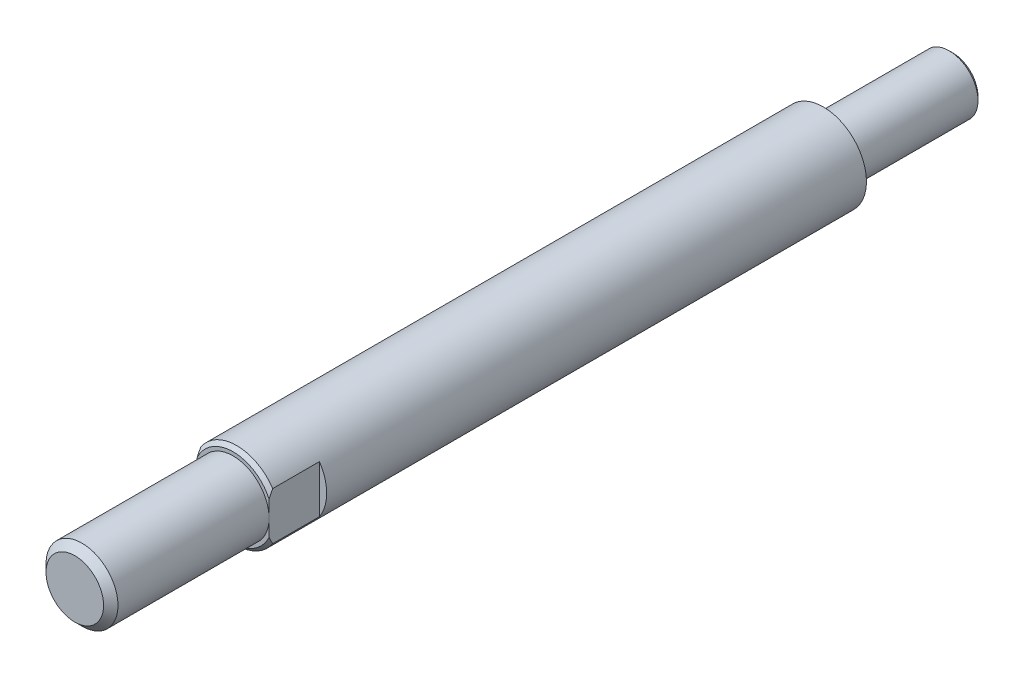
SolidWorks part; units mm, degrees
ref_plane "Face" through (0, 0, 0) normal (0, 0, 1) x (1, 0, 0)
ref_plane "Dessus" through (0, 0, 0) normal (0, 1, 0) x (1, 0, 0)
ref_plane "Profil" through (0, 0, 0) normal (1, 0, 0) x (0, 0, -1)
sketch "Esquisse1" plane through (0, 0, 0) normal (0, 0, 1) x (1, 0, 0)
  circle A0 centre (0, 0) radius 6
  dimension "D1" = 12
extrude "Extrusion1" add sketch "Esquisse1" along normal blind 122
sketch "Esquisse2" plane through (0, 0, 122) normal (0, 0, 1) x (1, 0, 0)
  circle A0 centre (0, 0) radius 5
  dimension "D1" = 10
extrude "Enlèv. mat.-Extru.1" cut sketch "Esquisse2" against normal blind 22 flip side to cut
sketch "Esquisse3" plane through (0, 0, 0) normal (0, 0, -1) x (-1, 0, 0)
  circle A0 centre (0, 0) radius 4
  dimension "D1" = 8
extrude "Enlèv. mat.-Extru.2" cut sketch "Esquisse3" against normal blind 18 flip side to cut
chamfer "Chanfrein1" distance 1 angle 45 1 edges at (5, 0, 122)
chamfer "Chanfrein2" distance 0.5 angle 45 2 edges at (-4, 0, 0) (6, 0, 100)
sketch "Esquisse4" plane through (0, 0, 0) normal (0, 1, 0) x (1, 0, 0)
  line L0 (0, -134.9896) -> (0, -87.421) construction
  line L1 (-5, -100) -> (5, -100) construction
  line L2 (6, -100) -> (5, -100)
  line L3 (6, -100) -> (6, -93)
  line L4 (6, -93) -> (5, -93)
  line L5 (5, -100) -> (5, -93)
  dimension "D1" = 10
  dimension "D2" = 7
extrude "Enlèv. mat.-Extru.3" cut sketch "Esquisse4" against normal through all and the other way through all
mirror "Symétrie1" about plane through (0, 0, 0) normal (1, 0, 0) of "Enlèv. mat.-Extru.3"
hole_wizard "Trou taraudé M6x1.01" positions "Esquisse7" profile "Esquisse6" tap size "M6x1.0" standard "ISO"
sketch "Esquisse7" plane through (0, 0, 0) normal (0, 0, -1) x (-1, 0, 0)
  circle A0 centre (0, 0) radius 6 construction
  point P0 (0, 0)
sketch "Esquisse6" plane through (0, 0, 0) normal (1, 0, 0) x (0, 1, 0)
  line L0 (0, 0) -> (0, 21.5022)
  line L1 (0, 21.5022) -> (2.5, 20)
  line L2 (2.5, 20) -> (2.5, 0.5)
  line L3 (2.5, 0.5) -> (3, 0)
  line L5 (3, 0) -> (0, 0)
  line L6 (-2.5, 0.5) -> (-3, 0) construction
  line L10 (0, 21.5022) -> (-2.5, 20) construction
  line L11 (0, -6.35) -> (0, 107.95) construction
  dimension "Diamètre du trou pour taraudage" = 5
  dimension "Profondeur du trou pour taraudage" = 20
  dimension "Diamètre du fraisage entrant" = 6
  dimension "Angle du fraisage entrant" = 90
  dimension "Angle de pointe" = 118
